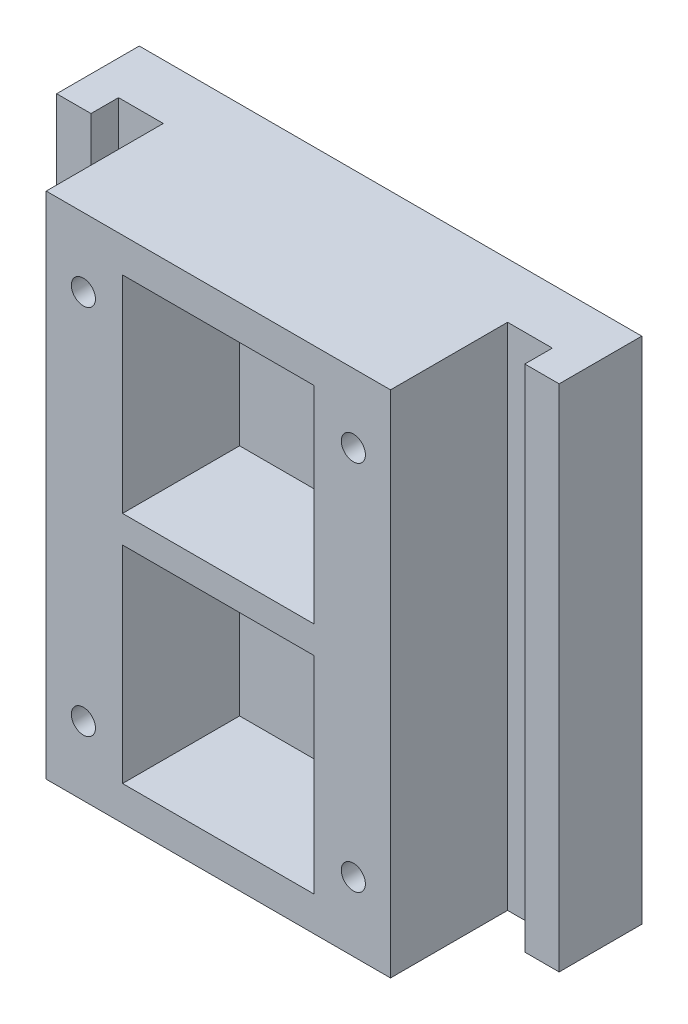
SolidWorks part; units mm, degrees
ref_plane "Front" through (0, 0, 0) normal (0, 0, 1) x (1, 0, 0)
ref_plane "Top" through (0, 0, 0) normal (0, 1, 0) x (1, 0, 0)
ref_plane "Right" through (0, 0, 0) normal (1, 0, 0) x (0, 0, -1)
sketch "Sketch1" plane through (0, 0, 0) normal (0, 0, 1) x (1, 0, 0)
  line L1 (0, 0) -> (149.3, 0)
  line L2 (0, 0) -> (0, 73.97)
  line L3 (0, 73.97) -> (149.3, 73.97)
  line L4 (149.3, 0) -> (149.3, 73.97)
  dimension "D1" = 73.97
  dimension "D2" = 149.3
extrude "Boss-Extrude1" add sketch "Sketch1" along normal blind 12
sketch "Sketch2" plane through (0, 0, 12) normal (0, 0, 1) x (1, 0, 0)
  line L1 (4.5, 64.92) -> (43.15, 64.92)
  line L2 (4.5, 64.92) -> (4.5, 58.42)
  line L3 (4.5, 58.42) -> (43.15, 58.42)
  line L4 (43.15, 64.92) -> (43.15, 58.42)
  line L5 (49.65, 68.72) -> (43.15, 68.72)
  line L6 (49.65, 68.72) -> (49.65, 4.87)
  line L7 (49.65, 4.87) -> (43.15, 4.87)
  line L8 (43.15, 68.72) -> (43.15, 4.87)
  line L9 (0, 73.97) -> (0, 0) construction
  line L10 (149.3, 73.97) -> (0, 73.97) construction
  line L11 (74.65, 0) -> (74.65, 93.9021) construction
  line L12 (147.8797, 67.9997) -> (147.8797, 55.3403)
  line L13 (96.5703, 1.7903) -> (109.2297, 1.7903)
  line L14 (99.65, 4.87) -> (106.15, 4.87)
  line L15 (144.8, 64.92) -> (106.15, 64.92)
  line L16 (144.8, 64.92) -> (144.8, 58.42)
  line L17 (104.9, -50.38) -> (-12.1, -50.38)
  line L18 (103.0703, 67.9997) -> (103.0703, 55.3403)
  line L19 (147.8797, 67.9997) -> (103.0703, 67.9997)
  line L20 (1.4203, 67.9997) -> (46.2297, 67.9997)
  line L21 (46.2297, 67.9997) -> (46.2297, 55.3403)
  line L22 (1.4203, 55.3403) -> (46.2297, 55.3403)
  line L23 (1.4203, 67.9997) -> (1.4203, 55.3403)
  line L24 (40.0703, 71.7997) -> (40.0703, 1.7903)
  line L25 (52.7297, 1.7903) -> (40.0703, 1.7903)
  line L26 (52.7297, 71.7997) -> (52.7297, 1.7903)
  line L27 (52.7297, 71.7997) -> (40.0703, 71.7997)
  line L28 (0, 0) -> (149.3, 0) construction
  line L29 (144.8, 58.42) -> (106.15, 58.42)
  line L30 (104.9, 123.97) -> (-12.1, 123.97) construction
  line L31 (147.8797, 55.3403) -> (103.0703, 55.3403)
  line L32 (109.2297, 71.7997) -> (109.2297, 1.7903)
  line L33 (104.9, 123.97) -> (104.9, -50.38) construction
  line L34 (96.5703, 71.7997) -> (109.2297, 71.7997)
  line L35 (-12.1, 123.97) -> (-12.1, -50.38) construction
  line L36 (96.5703, 71.7997) -> (96.5703, 1.7903)
  line L37 (106.15, 68.72) -> (106.15, 4.87)
  line L38 (99.65, 68.72) -> (106.15, 68.72)
  line L39 (99.65, 68.72) -> (99.65, 4.87)
  line L41 (88.5703, 5) -> (60.7297, 5)
  line L42 (88.5703, 5) -> (88.5703, 68.97)
  line L43 (88.5703, 68.97) -> (60.7297, 68.97)
  line L44 (60.7297, 5) -> (60.7297, 68.97)
  dimension "D1" = 6.5
  dimension "D2" = 6.5
  dimension "D3" = 38.65
  dimension "D4" = 4.5
  dimension "D5" = 5.25
  dimension "D6" = 63.85
  dimension "D7" = 3.8
  dimension "D10" = 8
  dimension "D11" = 8
  dimension "D12" = 5
  dimension "D13" = 5
  dimension "D8" = 55.25
  dimension "D9" = 3.0797
extrude "Cut-Extrude1" cut sketch "Sketch2" against normal blind 4
sketch "Sketch3" plane through (0, 0, 12) normal (0, 0, 1) x (1, 0, 0)
  line L0 (74.65, 0) -> (74.65, 84.7848) construction
  line L1 (0, 0) -> (38.1622, 0)
  line L2 (0, 0) -> (0, 80.739)
  line L3 (0, 80.739) -> (38.1622, 80.739)
  line L4 (38.1622, 0) -> (38.1622, 80.739)
  line L5 (0, 0) -> (149.3, 0) construction
  line L6 (149.3, 0) -> (111.1378, 0)
  line L7 (149.3, 0) -> (149.3, 80.739)
  line L8 (149.3, 80.739) -> (111.1378, 80.739)
  line L9 (111.1378, 0) -> (111.1378, 80.739)
extrude "Cut-Extrude2" cut sketch "Sketch3" against normal blind 20
ref_plane "Plane1" through (74.65, 0, 0) normal (-1, 0, 0) x (0, 0, 1)
sketch "Sketch6" plane through (0, 0, 12) normal (0, 0, 1) x (1, 0, 0)
  line L5 (38.1622, 0) -> (111.1378, 0) construction
  line L6 (106.15, 4.87) -> (99.65, 4.87)
  line L7 (106.15, 4.87) -> (106.15, 0)
  line L8 (106.15, 0) -> (99.65, 0)
  line L9 (99.65, 4.87) -> (99.65, 0)
  line L11 (49.65, 4.87) -> (43.15, 4.87)
  line L12 (49.65, 4.87) -> (49.65, 0)
  line L13 (49.65, 0) -> (43.15, 0)
  line L14 (43.15, 4.87) -> (43.15, 0)
  line L19 (111.1378, 73.97) -> (38.1622, 73.97) construction
  line L20 (43.15, 68.72) -> (49.65, 68.72)
  line L21 (43.15, 68.72) -> (43.15, 73.97)
  line L22 (43.15, 73.97) -> (49.65, 73.97)
  line L23 (49.65, 68.72) -> (49.65, 73.97)
  line L25 (99.65, 68.72) -> (106.15, 68.72)
  line L26 (99.65, 68.72) -> (99.65, 73.97)
  line L27 (99.65, 73.97) -> (106.15, 73.97)
  line L28 (106.15, 68.72) -> (106.15, 73.97)
  dimension "D1" = 6.5
  dimension "D2" = 6.5
  dimension "D4" = 6.5
  dimension "D5" = 6.5
extrude "Cut-Extrude3" cut sketch "Sketch6" against normal blind 4
sketch "Sketch7" plane through (0, 0, 12) normal (0, 0, 1) x (1, 0, 0)
  line L1 (99.65, 0) -> (49.65, 0)
  line L2 (99.65, 0) -> (99.65, 73.97)
  line L3 (99.65, 73.97) -> (49.65, 73.97)
  line L4 (49.65, 0) -> (49.65, 73.97)
  line L5 (88.5703, 5) -> (60.7297, 5)
  line L6 (88.5703, 5) -> (88.5703, 68.97)
  line L7 (88.5703, 68.97) -> (60.7297, 68.97)
  line L8 (60.7297, 5) -> (60.7297, 68.97)
extrude "Boss-Extrude2" add sketch "Sketch7" along normal blind 13
sketch "Sketch8" plane through (0, 0, 25) normal (0, 0, 1) x (1, 0, 0)
  line L0 (99.65, 73.97) -> (49.65, 73.97) construction
  line L1 (49.65, 0) -> (99.65, 0) construction
  circle A0 centre (94.2511, 63.97) radius 3
  circle A1 centre (94.2511, 10) radius 3
  dimension "D3" = 6
  dimension "D4" = 6
  dimension "D1" = 10
  dimension "D2" = 10
extrude "Cut-Extrude5" cut sketch "Sketch8" along normal blind 15 from surface at -25
sketch "Sketch9" plane through (0, 0, 25) normal (0, 0, 1) x (1, 0, 0)
  circle A0 centre (94.2511, 10) radius 1.75
  circle A1 centre (94.2511, 63.97) radius 1.75
  dimension "D1" = 3.5
  dimension "D2" = 3.5
extrude "Cut-Extrude6" cut sketch "Sketch9" against normal through all
mirror "Mirror1" about plane through (74.65, 0, 0) normal (-1, 0, 0) of "Cut-Extrude5", "Cut-Extrude6"
sketch "Sketch11" plane through (0, 0, 8) normal (0, 0, 1) x (1, 0, 0)
  line L0 (60.7297, 5) -> (60.7297, 68.97) construction
  line L1 (60.7297, 35) -> (88.5703, 35)
  line L2 (60.7297, 35) -> (60.7297, 38.97)
  line L3 (60.7297, 38.97) -> (88.5703, 38.97)
  line L4 (88.5703, 35) -> (88.5703, 38.97)
  line L5 (88.5703, 5) -> (88.5703, 68.97) construction
  line L6 (88.5703, 5) -> (60.7297, 5) construction
  line L7 (88.5703, 68.97) -> (60.7297, 68.97) construction
  dimension "D1" = 30
  dimension "D2" = 30
extrude "Boss-Extrude3" add sketch "Sketch11" along normal blind 17
